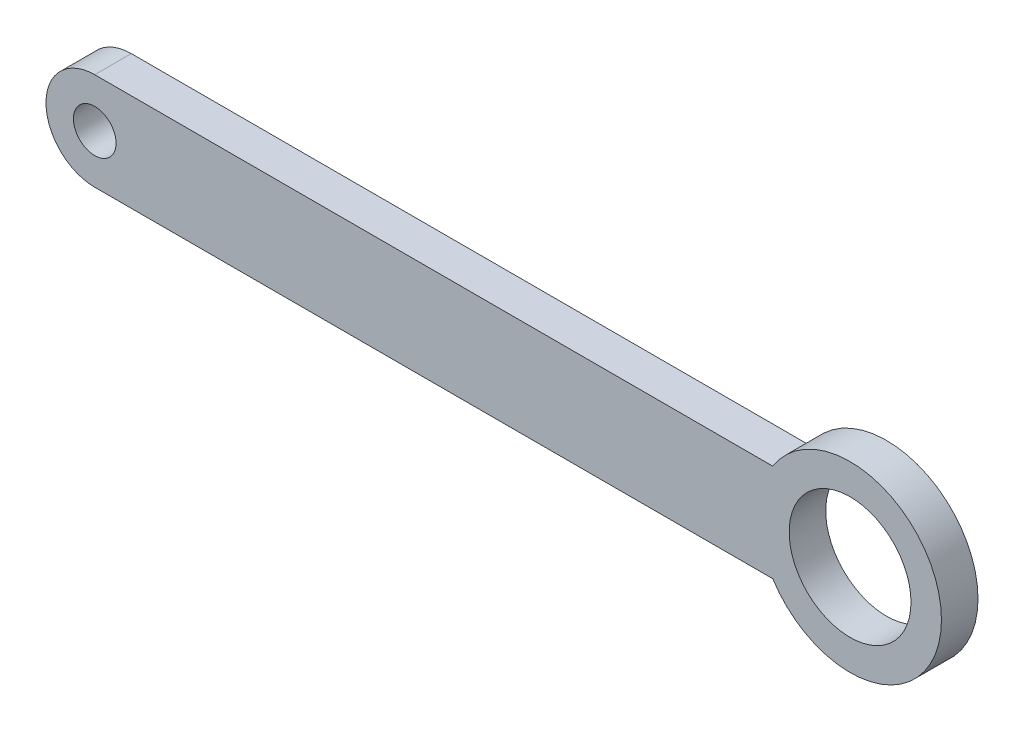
SolidWorks part; units mm, degrees
ref_plane "Plan de face" through (0, 0, 0) normal (0, 0, 1) x (1, 0, 0)
ref_plane "Plan de dessus" through (0, 0, 0) normal (0, 1, 0) x (1, 0, 0)
ref_plane "Plan de droite" through (0, 0, 0) normal (1, 0, 0) x (0, 0, -1)
sketch "Esquisse1" plane through (0, 0, 0) normal (0, 0, 1) x (1, 0, 0)
  line L0 (0, 0) -> (-62, 0)
  line L1 (-62, 4) -> (-6.3443, 4)
  line L2 (-62, -4) -> (-6.3443, -4)
  circle A0 centre (0, 0) radius 5
  arc A1 (-6.3443, -4) -> (-6.3443, 4) centre (0, 0) ccw
  circle A2 centre (-62, 0) radius 1.75
  arc A3 (-62, 4) -> (-62, -4) centre (-62, 0) ccw
  dimension "D1" = 10
  dimension "D2" = 15
  dimension "D4" = 3.5
  dimension "D5" = 8
  dimension "D3" = 62
extrude "Boss.-Extru.1" add sketch "Esquisse1" along normal blind 3
